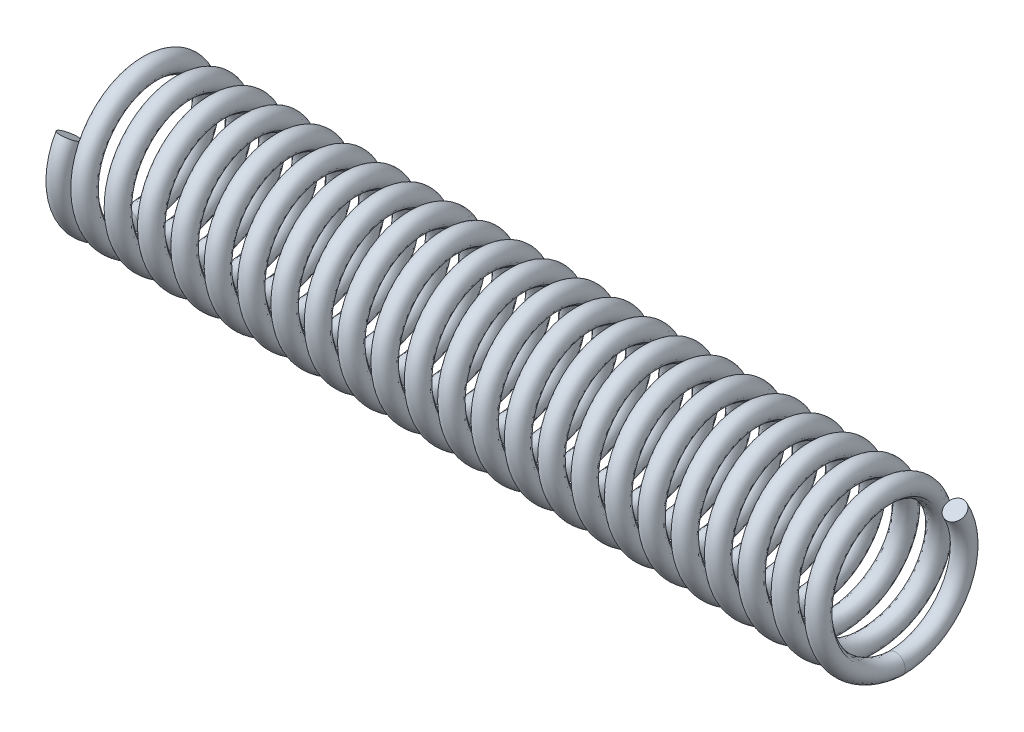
SolidWorks part; units mm, degrees
ref_plane "Спереди" through (0, 0, 0) normal (0, 0, 1) x (1, 0, 0)
ref_plane "Сверху" through (0, 0, 0) normal (0, 1, 0) x (1, 0, 0)
ref_plane "Справа" through (0, 0, 0) normal (1, 0, 0) x (0, 0, -1)
sketch "Эскиз1" plane through (0, 0, 0) normal (0, 0, 1) x (1, 0, 0)
  line L0 (-3.6322, 4.7625) -> (-3.6322, -4.7625) construction
  circle A0 centre (-4.2291, -4.191) radius 0.5969
  dimension "D1" = 1.1938
  dimension "D2" = 4.191
sketch "Эскиз2" plane through (0, 0, 0) normal (0, 0, 1) x (1, 0, 0)
  line L0 (-4.2291, 0) -> (-51.0287, 0)
  line L1 (-51.6256, -5.1054) -> (-51.6256, 5.1054) construction
  dimension "D1" = 0.5969
sweep "По траектории1" add profiles "Эскиз1" path "Эскиз2" parameters "D1"=8280
sketch "Эскиз3" plane through (0, 0, 0) normal (0, 0, -1) x (-1, 0, 0)
  line L0 (3.0375, 0) -> (6.7962, 0) construction
  circle A0 centre (4.2291, -4.191) radius 0.5969 construction
  circle A1 centre (4.2291, -4.191) radius 0.5969
revolve "Повернуть1" add sketch "Эскиз3" angle 120 about L0
sketch "Эскиз4" plane through (0, 0, 0) normal (0, 0, 1) x (1, 0, 0)
  line L0 (-53.7257, 0) -> (-44.6644, 0) construction
  circle A0 centre (-51.0287, -4.191) radius 0.5969 construction
  circle A1 centre (-51.0287, -4.191) radius 0.5969
revolve "Повернуть2" add sketch "Эскиз4" angle 120 about L0
